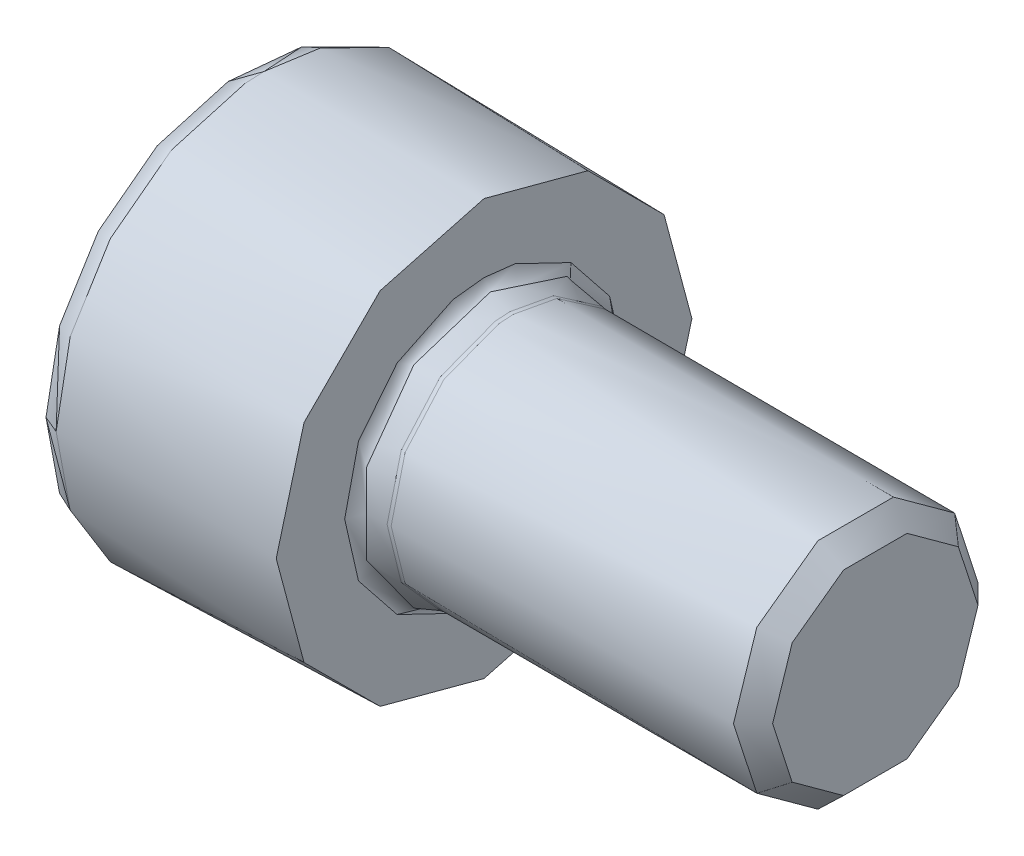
SolidWorks part; units mm, degrees
ref_plane "Front" through (0, 0, 0) normal (0, 0, 1) x (1, 0, 0)
ref_plane "Top" through (0, 0, 0) normal (0, 1, 0) x (1, 0, 0)
ref_plane "Right" through (0, 0, 0) normal (1, 0, 0) x (0, 0, -1)
imported_body "CHC M5-8"
sketch "Esquisse1" plane through (10, 0, 0) normal (1, 0, 0) x (0, 0, -1)
  circle A0 centre (0, 0) radius 2.5
  dimension "D1" = 5
extrude "Enlèv. mat.-Extru.1" cut sketch "Esquisse1" against normal blind 2
chamfer "Chanfrein1" distance 0.4 angle 45 1 edges at (8, 0, -2.5)
